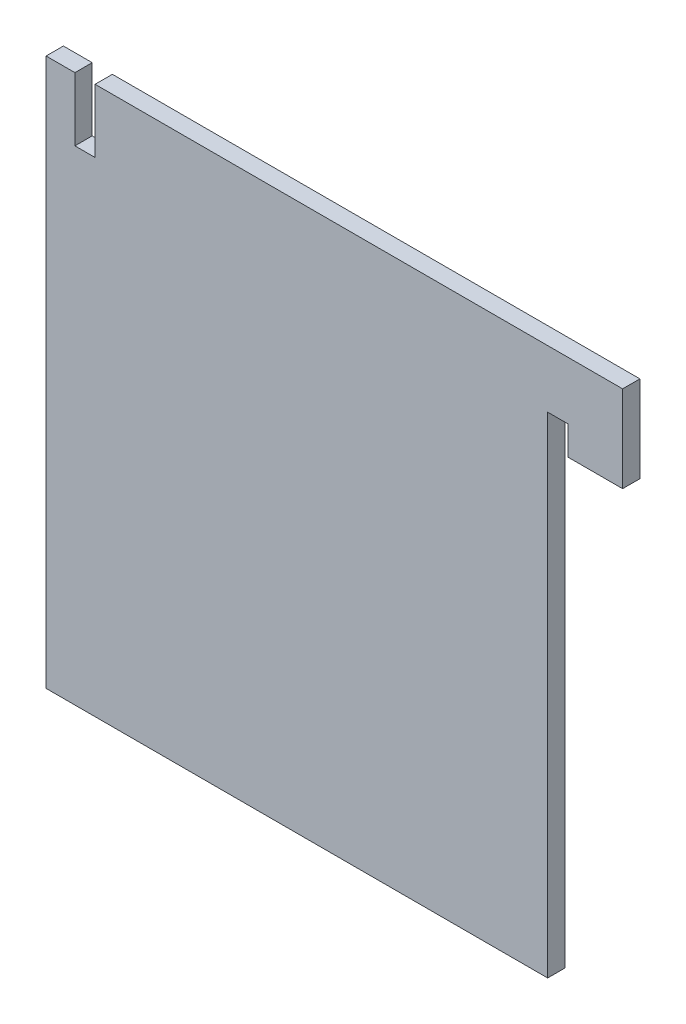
SolidWorks part; units mm, degrees
ref_plane "Plan de face" through (0, 0, 0) normal (0, 0, 1) x (1, 0, 0)
ref_plane "Plan de dessus" through (0, 0, 0) normal (0, 1, 0) x (1, 0, 0)
ref_plane "Plan de droite" through (0, 0, 0) normal (1, 0, 0) x (0, 0, -1)
sketch "Esquisse1" plane through (0, 0, 0) normal (0, 0, 1) x (1, 0, 0)
  line L1 (0, 0) -> (100, 0)
  line L2 (0, 0) -> (0, 95)
  line L3 (0, 95) -> (100, 95)
  line L4 (100, 0) -> (100, 95)
  dimension "D1" = 100
  dimension "D2" = 95
extrude "Extrusion1" add sketch "Esquisse1" along normal blind 3
sketch "Esquisse2" plane through (0, 0, 3) normal (0, 0, 1) x (1, 0, 0)
  line L1 (100, 0) -> (87, 0)
  line L2 (100, 0) -> (100, 80)
  line L3 (100, 80) -> (87, 80)
  line L4 (87, 0) -> (87, 80)
  dimension "D1" = 80
  dimension "D2" = 13
extrude "Enlèv. mat.-Extru.1" cut sketch "Esquisse2" against normal blind 3
sketch "Esquisse3" plane through (0, 0, 3) normal (0, 0, 1) x (1, 0, 0)
  line L0 (100, 95) -> (0, 95) construction
  line L1 (5, 95) -> (8.5, 95)
  line L2 (5, 95) -> (5, 84)
  line L3 (5, 84) -> (8.5, 84)
  line L4 (8.5, 95) -> (8.5, 84)
  dimension "D1" = 3.5
  dimension "D2" = 11
  dimension "D3" = 5
extrude "Enlèv. mat.-Extru.2" cut sketch "Esquisse3" against normal blind 3
sketch "Esquisse4" plane through (0, 0, 3) normal (0, 0, 1) x (1, 0, 0)
  line L1 (87, 80) -> (90.5, 80)
  line L2 (87, 80) -> (87, 85)
  line L3 (87, 85) -> (90.5, 85)
  line L4 (90.5, 80) -> (90.5, 85)
  dimension "D1" = 3.5
  dimension "D2" = 5
extrude "Enlèv. mat.-Extru.3" cut sketch "Esquisse4" against normal blind 3
